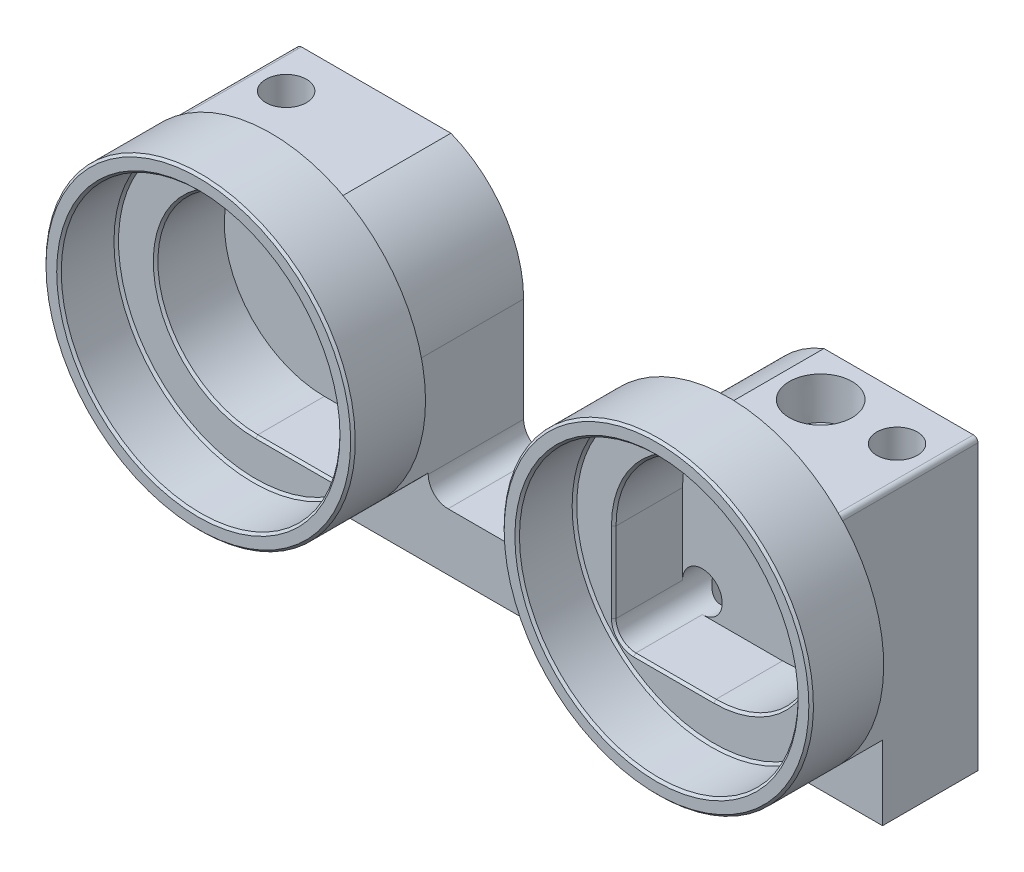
SolidWorks part; units mm, degrees
ref_plane "Front Plane" through (0, 0, 0) normal (0, 0, 1) x (1, 0, 0)
ref_plane "Top Plane" through (0, 0, 0) normal (0, 1, 0) x (1, 0, 0)
ref_plane "Right Plane" through (0, 0, 0) normal (1, 0, 0) x (0, 0, -1)
sketch "Sketch1" plane through (0, 0, 0) normal (0, 0, 1) x (1, 0, 0)
  line L1 (0, 0) -> (139.7, 0)
  line L2 (0, 0) -> (0, 60.325)
  line L3 (0, 60.325) -> (139.7, 60.325)
  line L4 (139.7, 0) -> (139.7, 60.325)
  dimension "D1" = 60.325
  dimension "D2" = 139.7
extrude "BAR STOCK" add sketch "Sketch1" along normal blind 34.925
sketch "Sketch3" plane through (0, 0, 34.925) normal (0, 0, 1) x (1, 0, 0)
  line L0 (69.85, 60.325) -> (69.85, -16.0681) construction
  line L1 (139.7, 60.325) -> (0, 60.325) construction
  line L2 (0, 30.1625) -> (211.9405, 30.1625) construction
  line L3 (0, 60.325) -> (0, 0) construction
  circle A0 centre (31.75, 30.1625) radius 23.1775
  circle A1 centre (107.95, 30.1625) radius 23.1775
  dimension "D1" = 46.355
  dimension "D3" = 46.355
  dimension "D2" = 38.1
  dimension "D4" = 38.1
extrude "pump holes" cut sketch "Sketch3" against normal blind 9.525
sketch "Sketch4" plane through (0, 0, 25.4) normal (0, 0, 1) x (1, 0, 0)
  line L0 (31.75, 13.5255) -> (45.085, 13.5255)
  line L1 (48.387, 30.1625) -> (48.387, 16.8275)
  line L2 (91.313, 30.1625) -> (91.313, 16.8275)
  line L3 (107.95, 13.5255) -> (94.615, 13.5255)
  arc A0 (48.387, 30.1625) -> (31.75, 13.5255) centre (31.75, 30.1625) ccw
  arc A1 (107.95, 13.5255) -> (91.313, 30.1625) centre (107.95, 30.1625) ccw
  arc A2 (91.313, 16.8275) -> (94.615, 13.5255) centre (94.615, 16.8275) ccw
  arc A3 (48.387, 16.8275) -> (45.085, 13.5255) centre (45.085, 16.8275) cw
  point P14 (0, 0)
  dimension "D1" = 33.274
  dimension "D2" = 33.274
  dimension "D3" = 3.302
extrude "pump volute" cut sketch "Sketch4" against normal blind 11.43
sketch "Sketch5" plane through (0, 0, 13.97) normal (0, 0, 1) x (1, 0, 0)
  circle A0 centre (31.75, 30.1625) radius 4.7625
  circle A1 centre (107.95, 30.1625) radius 4.7625
  circle A2 centre (94.615, 16.8275) radius 3.302
  circle A3 centre (45.085, 16.8275) radius 3.302
  dimension "D1" = 9.525
  dimension "D2" = 9.525
extrude "pump flow holes" cut sketch "Sketch5" against normal blind 6.35
sketch "Sketch6" plane through (0, 0, 0) normal (0, -1, 0) x (1, 0, 0)
  line L0 (-0.7642, 7.62) -> (112.7125, 7.62) construction
  line L2 (31.75, 7.62) -> (31.75, 25.3945) construction
  line L3 (36.5125, 7.62) -> (26.9875, 7.62) construction
  line L4 (45.085, 7.62) -> (45.085, 13.4169) construction
  line L5 (48.387, 7.62) -> (41.783, 7.62) construction
  line L6 (45.085, 13.97) -> (45.085, 25.4) construction
  circle A0 centre (31.75, 7.62) radius 3.3782
  dimension "D1" = 13.335
  dimension "D3" = 6.7564
extrude "stir inlet" cut sketch "Sketch6" against normal blind 34.925
sketch "Sketch7" plane through (0, 0, 0) normal (0, -1, 0) x (1, 0, 0)
  line L0 (31.75, 7.62) -> (121.5146, 7.62) construction
  line L1 (45.085, 7.62) -> (45.085, 9.7353) construction
  line L2 (48.387, 7.62) -> (41.783, 7.62) construction
  line L3 (94.615, 7.62) -> (94.615, 15.1152) construction
  line L4 (97.917, 7.62) -> (91.313, 7.62) construction
  circle A0 centre (45.085, 7.62) radius 3.3782
  circle A1 centre (94.615, 7.62) radius 3.3782
  dimension "D1" = 6.7564
  dimension "D2" = 6.7564
extrude "stir flush out" cut sketch "Sketch7" against normal blind 19.05
sketch "Sketch10" plane through (0, 0, 0) normal (0, -1, 0) x (1, 0, 0)
  line L0 (3.7298, 7.62) -> (135.9702, 7.62) construction
  line L1 (69.85, 0) -> (69.85, 30.8232) construction
  line L2 (0, 0) -> (139.7, 0) construction
  circle A1 centre (19.05, 7.62) radius 3.3782
  circle A2 centre (120.65, 7.62) radius 3.3782
  dimension "D1" = 6.7564
  dimension "D2" = 50.8
  dimension "D3" = 6.7564
  dimension "D4" = 50.8
extrude "mounting holes" cut sketch "Sketch10" against normal through all
sketch "Sketch11" plane through (0, 0, 34.925) normal (0, 0, 1) x (1, 0, 0)
  line L8 (0, 60.325) -> (0, 0)
  line L9 (0, 0) -> (139.7, 0)
  line L10 (139.7, 0) -> (139.7, 60.325)
  line L11 (139.7, 60.325) -> (0, 60.325)
  line L12 (0, 60.325) -> (0, 0)
  line L13 (0, 0) -> (139.7, 0)
  line L14 (139.7, 0) -> (139.7, 60.325)
  line L15 (139.7, 60.325) -> (0, 60.325)
  circle A6 centre (31.75, 30.1625) radius 25.7175
  circle A7 centre (31.75, 30.1625) radius 25.7175
  circle A9 centre (107.95, 30.1625) radius 25.7175
  circle A10 centre (107.95, 30.1625) radius 25.7175
  dimension "D1" = 2.54
  dimension "D2" = 2.54
  dimension "D3" = 0
extrude "weight relif 1" cut sketch "Sketch11" against normal blind 19.05
sketch "Sketch12" plane through (0, 0, 15.875) normal (0, 0, 1) x (1, 0, 0)
  line L0 (55.0226, 9.525) -> (84.6774, 9.525)
  line L1 (9.525, 16.3602) -> (9.525, 0)
  line L3 (69.85, 60.325) -> (69.85, 48.0842) construction
  line L4 (139.7, 60.325) -> (0, 60.325)
  line L5 (0, 60.325) -> (0, 0)
  line L6 (0, 0) -> (9.525, 0)
  line L9 (139.7, 60.325) -> (139.7, 0)
  line L10 (0, 0) -> (139.7, 0) construction
  line L11 (139.7, 0) -> (130.175, 0)
  line L12 (130.175, 16.3602) -> (130.175, 0)
  line L18 (139.7, 60.325) -> (0, 60.325) construction
  circle A0 centre (31.75, 30.1625) radius 25.7175 construction
  arc A1 (52.3745, 14.7995) -> (9.1276, 17.9307) centre (31.75, 30.1625) ccw
  circle A3 centre (107.95, 30.1625) radius 25.7175 construction
  arc A4 (130.5724, 17.9307) -> (87.3255, 14.7995) centre (107.95, 30.1625) ccw
  arc A5 (87.3255, 14.7995) -> (84.6774, 9.525) centre (84.6774, 12.827) cw
  arc A6 (55.0226, 9.525) -> (52.3745, 14.7995) centre (55.0226, 12.827) cw
  arc A8 (130.175, 16.3602) -> (130.5724, 17.9307) centre (133.477, 16.3602) cw
  arc A16 (9.1276, 17.9307) -> (9.525, 16.3602) centre (6.223, 16.3602) cw
  point P17 (47.0955, 9.525)
  point P31 (130.175, 16.0026)
  point P44 (9.525, 17.2227)
  dimension "D8" = 3.302
  dimension "D4" = 3.302
  dimension "D5" = 3.302
  dimension "D2" = 60.325
  dimension "D3" = 9.525
  dimension "D1" = 60.325
extrude "profile cut" cut sketch "Sketch12" against normal through all
ref_plane "Plane1" through (0, 55.88, 0) normal (0, 1, 0) x (1, 0, 0)
sketch "Sketch13" plane through (0, 0, 0) normal (0, 0, -1) x (-1, 0, 0)
  line L0 (-69.85, 0) -> (-69.85, 68.6634) construction
  line L1 (-84.6774, 9.525) -> (-85.471, 9.525)
  line L2 (-126.492, 0) -> (-126.492, 47.2214)
  line L3 (-13.97, 47.9834) -> (-38.8333, 47.9834)
  line L4 (-130.175, 16.3602) -> (-130.175, 0)
  line L5 (-130.175, 0) -> (-9.525, 0)
  line L6 (-9.525, 0) -> (-9.525, 16.3602)
  line L7 (-55.0226, 9.525) -> (-84.6774, 9.525)
  line L8 (-130.175, 16.3602) -> (-130.175, 0)
  line L9 (-88.773, 30.1625) -> (-88.773, 12.827)
  line L10 (-9.525, 0) -> (-130.175, 0) construction
  line L11 (-13.208, 0) -> (-9.525, 0)
  line L12 (-130.175, 16.3602) -> (-130.175, 0) construction
  line L13 (-125.73, 47.9834) -> (-100.8667, 47.9834)
  line L14 (-91.313, 30.1625) -> (-91.313, 16.8275) construction
  line L16 (-50.927, 30.1625) -> (-50.927, 12.827)
  line L17 (-9.525, 16.3602) -> (-9.525, 0)
  line L18 (-13.208, 0) -> (-13.208, 47.2214)
  line L19 (-55.0226, 9.525) -> (-54.229, 9.525)
  line L22 (-126.492, 0) -> (-130.175, 0)
  line L29 (-120.65, 2.9091) -> (-120.65, 55.6274) construction
  arc A0 (-88.773, 30.1625) -> (-100.8667, 47.9834) centre (-107.95, 30.1625) ccw
  arc A1 (-126.492, 47.9834) -> (-130.5724, 17.9307) centre (-107.95, 30.1625) ccw
  arc A2 (-85.471, 9.525) -> (-88.773, 12.827) centre (-85.471, 12.827) cw
  arc A3 (-125.73, 47.9834) -> (-126.492, 47.2214) centre (-125.73, 47.2214) ccw
  arc A5 (-9.525, 16.3602) -> (-9.1276, 17.9307) centre (-6.223, 16.3602) cw
  arc A6 (-9.1276, 17.9307) -> (-9.525, 16.3602) centre (-6.223, 16.3602) ccw
  arc A7 (-9.1276, 17.9307) -> (-52.3745, 14.7995) centre (-31.75, 30.1625) ccw
  arc A8 (-55.0226, 9.525) -> (-52.3745, 14.7995) centre (-55.0226, 12.827) ccw
  arc A9 (-87.3255, 14.7995) -> (-84.6774, 9.525) centre (-84.6774, 12.827) ccw
  arc A10 (-87.3255, 14.7995) -> (-130.5724, 17.9307) centre (-107.95, 30.1625) ccw
  arc A11 (-130.175, 16.3602) -> (-130.5724, 17.9307) centre (-133.477, 16.3602) ccw
  arc A12 (-52.3745, 14.7995) -> (-13.208, 47.9834) centre (-31.75, 30.1625) cw
  arc A13 (-52.3745, 14.7995) -> (-55.0226, 9.525) centre (-55.0226, 12.827) cw
  arc A15 (-87.3255, 14.7995) -> (-84.6774, 9.525) centre (-84.6774, 12.827) ccw
  arc A16 (-87.3255, 14.7995) -> (-126.492, 47.9834) centre (-107.95, 30.1625) ccw
  arc A17 (-130.175, 16.3602) -> (-130.5724, 17.9307) centre (-133.477, 16.3602) ccw
  arc A18 (-13.97, 47.9834) -> (-13.208, 47.2214) centre (-13.97, 47.2214) cw
  arc A19 (-54.229, 9.525) -> (-50.927, 12.827) centre (-54.229, 12.827) ccw
  arc A20 (-13.208, 47.9834) -> (-9.1276, 17.9307) centre (-31.75, 30.1625) cw
  arc A21 (-50.927, 30.1625) -> (-38.8333, 47.9834) centre (-31.75, 30.1625) cw
  dimension "D5" = 3.302
  dimension "D6" = 9.525
  dimension "D7" = 0.762
  dimension "D3" = 5.842
  dimension "D4" = 2.54
  dimension "D1" = 0
extrude "rear cut 1" cut sketch "Sketch13" against normal blind 22.86
sketch "Sketch14" plane through (0, 47.9834, 0) normal (0, 1, 0) x (1, 0, 0)
  line L0 (107.95, -7.62) -> (107.95, 3.6647) construction
  line L1 (103.1875, -7.62) -> (112.7125, -7.62) construction
  circle A0 centre (107.95, -7.62) radius 3.81
  dimension "D1" = 7.62
extrude "flush inlet" cut sketch "Sketch14" against normal blind 22.86
sketch "Sketch15" plane through (0, 0, 0) normal (0, -1, 0) x (1, 0, 0)
  line L0 (47.5271, 7.62) -> (42.6429, 7.62) construction
  line L1 (97.0571, 7.62) -> (92.1729, 7.62) construction
  circle A0 centre (31.75, 7.62) radius 3.9751
  circle A1 centre (45.085, 7.62) radius 3.9751
  circle A2 centre (94.615, 7.62) radius 3.9751
  dimension "D1" = 7.9502
  dimension "D2" = 7.9502
  dimension "D3" = 7.9502
extrude "port tube c bores" cut sketch "Sketch15" against normal blind 9.525
sketch "Sketch16" plane through (0, 0, 0) normal (0, -1, 0) x (1, 0, 0)
  line L0 (97.0571, 7.62) -> (92.1729, 7.62) construction
  circle A0 centre (31.75, 7.62) radius 6.0071
  circle A1 centre (45.085, 7.62) radius 6.0071
  circle A2 centre (94.615, 7.62) radius 6.0071
  dimension "D1" = 12.0142
  dimension "D2" = 12.0142
  dimension "D3" = 12.0142
extrude "orings bores" cut sketch "Sketch16" against normal blind 1.3716
chamfer "Chamfer1" distance 0.381 angle 45 14 edges at (131.1275, 30.1625, 25.4) (101.2825, 13.5255, 25.4) (119.7141, 41.9266, 25.4) (91.313, 23.495, 25.4) (92.2801, 14.4926, 25.4) (133.6675, 30.1625, 34.925) (131.1275, 30.1625, 34.925) (54.9275, 30.1625, 25.4) (38.4175, 13.5255, 25.4) (47.4199, 14.4926, 25.4) (48.387, 23.495, 25.4) (19.9859, 41.9266, 25.4) (57.4675, 30.1625, 34.925) (54.9275, 30.1625, 34.925)
hole_wizard "1/8 NPT Tapped Hole1" positions "Sketch18" profile "Sketch17" size "1/8" standard "ANSI Inch"
sketch "Sketch18" plane through (0, 47.9834, 0) normal (0, 1, 0) x (1, 0, 0)
  point P0 (107.95, -7.62)
sketch "Sketch17" plane through (107.95, 47.9834, 7.62) normal (1, 0, 0) x (0, 0, 1)
  line L0 (0, 0) -> (0, 16.7575)
  line L1 (4.2164, 14.224) -> (0, 16.7575)
  line L2 (-4.2164, 14.224) -> (0, 16.7575) construction
  line L3 (4.2164, 14.224) -> (4.2164, 6.858)
  line L4 (4.2164, 6.858) -> (5.0122, 6.858)
  line L5 (5.0122, 6.858) -> (5.2176, 0)
  line L6 (-5.0122, 6.858) -> (-5.2176, 0) construction
  line L7 (5.2176, 0) -> (0, 0)
  line L8 (0, -6.35) -> (0, 107.95) construction
  line L11 (-4.2164, 6.858) -> (-5.0122, 6.858) construction
  dimension "Tap Drill Dia." = 8.4328
  dimension "Tap Drill Depth" = 14.224
  dimension "Thread Dia." = 10.4352
  dimension "Thread Angle" = 3.43
  dimension "Thread Depth" = 6.858
  dimension "Drill Angle" = 118
ref_plane "Plane2" through (69.85, 0, 0) normal (-1, 0, 0) x (0, 0, 1)
